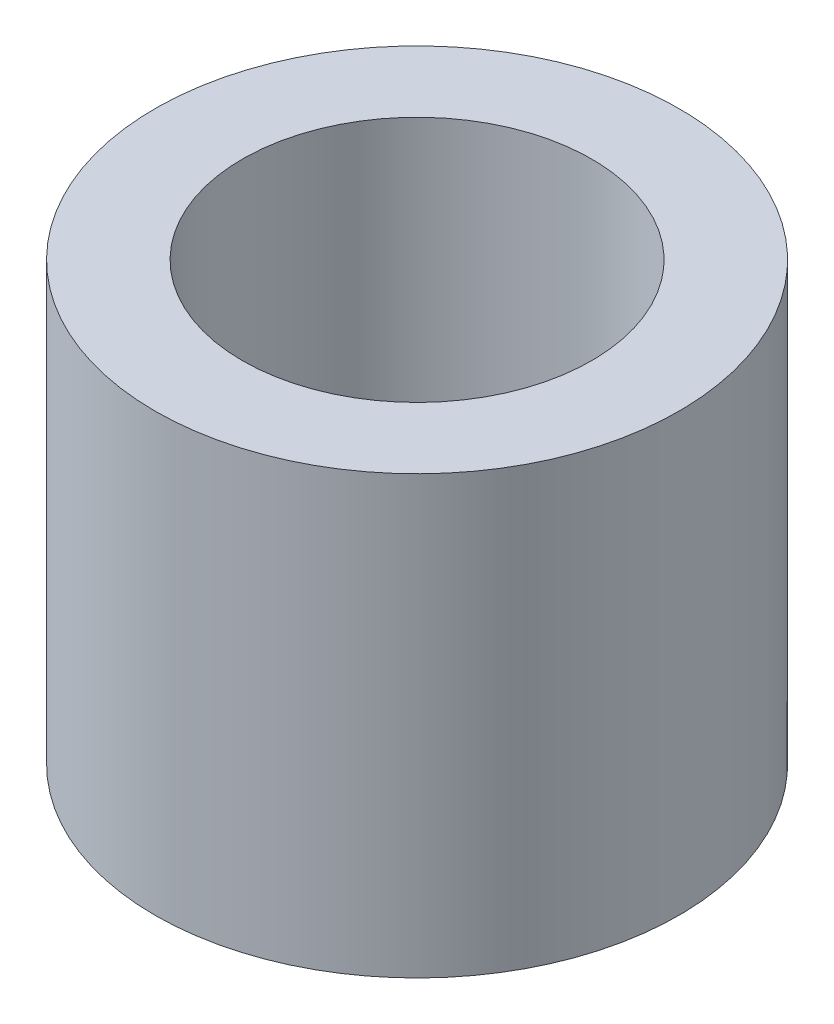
SolidWorks part; units mm, degrees
ref_plane "Plan de face" through (0, 0, 0) normal (0, 0, 1) x (1, 0, 0)
ref_plane "Plan de dessus" through (0, 0, 0) normal (0, 1, 0) x (1, 0, 0)
ref_plane "Plan de droite" through (0, 0, 0) normal (1, 0, 0) x (0, 0, -1)
sketch "Esquisse1" plane through (0, 0, 0) normal (0, 1, 0) x (1, 0, 0)
  circle A0 centre (0, 0) radius 6
  circle A1 centre (0, 0) radius 4
  dimension "D1" = 8
  dimension "D2" = 12
extrude "Extrusion1" add sketch "Esquisse1" along normal blind 10
